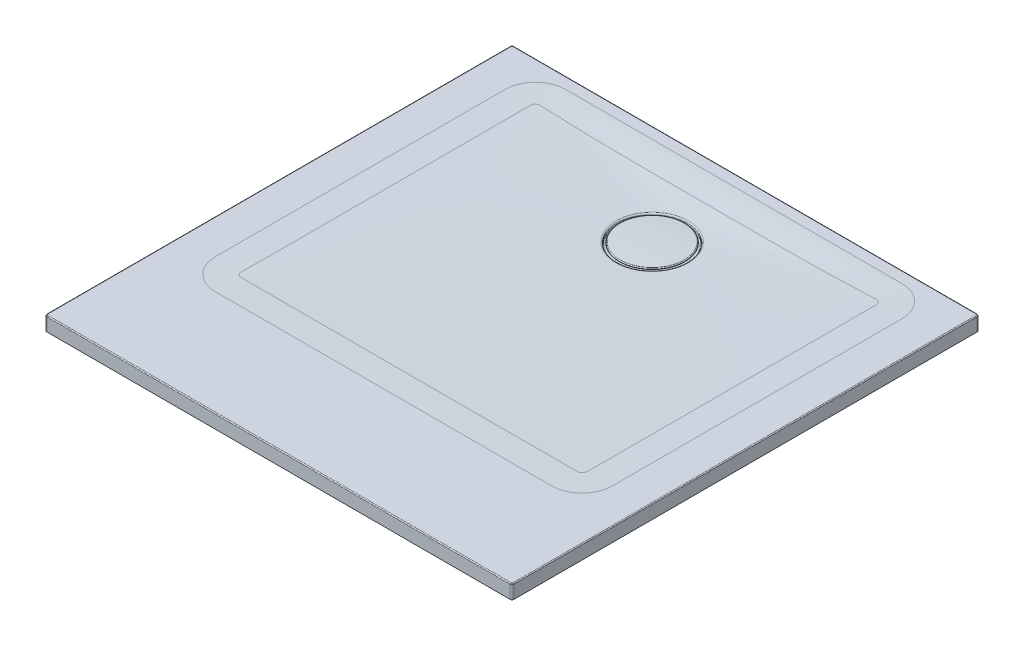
SolidWorks part; units mm, degrees
ref_plane "Płaszczyzna przednia" through (0, 0, 0) normal (0, 0, 1) x (1, 0, 0)
ref_plane "Płaszczyzna górna" through (0, 0, 0) normal (0, 1, 0) x (1, 0, 0)
ref_plane "Płaszczyzna prawa" through (0, 0, 0) normal (1, 0, 0) x (0, 0, -1)
sketch "Szkic2" plane through (0, 0, 0) normal (0, 1, 0) x (1, 0, 0)
  line L0 (0, 500) -> (0, 300) construction
  line L1 (-500, -500) -> (500, -500)
  line L2 (-500, -500) -> (-500, 500)
  line L3 (-500, 500) -> (500, 500)
  line L4 (500, -500) -> (500, 500)
  line L5 (-500, -500) -> (500, 500) construction
  line L6 (-500, 500) -> (500, -500) construction
  line L7 (-410, 460) -> (410, 460)
  line L8 (-410, 460) -> (-410, -260)
  line L9 (-410, -260) -> (410, -260)
  line L10 (410, 460) -> (410, -260)
  line L11 (-450, 500) -> (-450, -300) construction
  line L12 (-450, -300) -> (450, -300) construction
  line L13 (450, -300) -> (450, 500) construction
  circle A0 centre (0, 300) radius 75
  point P0 (0, 0)
  point P11 (0, 460)
  point P16 (0, -300)
  dimension "D9" = 150
  dimension "D1" = 1000
  dimension "D2" = 1000
  dimension "D3" = 40
  dimension "D4" = 90
  dimension "D5" = 40
  dimension "D6" = 50
  dimension "D7" = 800
  dimension "D8" = 200
  dimension "D10" = 900
sketch "Szkic3" plane through (0, 0, 0) normal (0, 1, 0) x (1, 0, 0)
  line L0 (-500, -500) -> (-500, 500) construction
  line L1 (-500, -500) -> (500, -500) construction
  line L2 (500, -500) -> (500, 500) construction
  line L3 (-500, 500) -> (500, 500) construction
  line L4 (-410, 460) -> (-410, -260) construction
  line L5 (-410, 460) -> (410, 460) construction
  line L6 (410, 460) -> (410, -260) construction
  line L7 (-410, -260) -> (410, -260) construction
  line L8 (-500, -500) -> (-500, 500)
  line L9 (-500, -500) -> (500, -500)
  line L10 (500, -500) -> (500, 500)
  line L11 (-500, 500) -> (500, 500)
  line L12 (-410, 410) -> (-410, -210)
  line L13 (-360, 460) -> (360, 460)
  line L14 (410, 410) -> (410, -210)
  line L15 (-360, -260) -> (360, -260)
  arc A0 (410, 410) -> (360, 460) centre (360, 410) ccw
  arc A1 (-360, 460) -> (-410, 410) centre (-360, 410) ccw
  arc A2 (360, -260) -> (410, -210) centre (360, -210) ccw
  arc A3 (-360, -260) -> (-410, -210) centre (-360, -210) cw
  dimension "D1" = 50
surface "Powierzchnia-Płaszczyzna1" sketch "Szkic3"
sketch "Szkic4" plane through (0, 0, 0) normal (0, 1, 0) x (1, 0, 0)
  line L0 (-410, 460) -> (-410, -260) construction
  line L1 (-410, -260) -> (410, -260) construction
  line L2 (410, 460) -> (410, -260) construction
  line L3 (-410, 460) -> (410, 460) construction
  line L4 (-410, 460) -> (-410, -260)
  line L5 (-410, -260) -> (410, -260)
  line L6 (410, 460) -> (410, -260)
  line L7 (-410, 460) -> (410, 460)
ref_plane "korek" through (0, -15, 0) normal (0, 1, 0) x (-1, 0, 0)
sketch "Szkic5" plane through (0, -15, 0) normal (0, 1, 0) x (-1, 0, 0)
  circle A0 centre (0, -300) radius 75 construction
  circle A1 centre (0, -300) radius 75
surface "Powierzchnia-Wyciągnięcie po profilach2"
surface "Powierzchnia-Połącz1"
sketch "Szkic7" plane through (0, 0, 0) normal (0, 1, 0) x (1, 0, 0)
  line L27 (360, 420) -> (-360, 420)
  line L28 (-370, 410) -> (-370, -210)
  line L29 (-360, -220) -> (360, -220)
  line L30 (370, -210) -> (370, 410)
  line L31 (360, 420) -> (-360, 420)
  line L32 (-370, 410) -> (-370, -210)
  line L33 (-360, -220) -> (360, -220)
  line L34 (370, -210) -> (370, 410)
  line L35 (360, 475) -> (-360, 475)
  line L36 (-425, 410) -> (-425, -210)
  line L37 (-360, -275) -> (360, -275)
  line L38 (425, -210) -> (425, 410)
  line L39 (360, 475) -> (-360, 475)
  line L40 (-425, 410) -> (-425, -210)
  line L41 (-360, -275) -> (360, -275)
  line L42 (425, -210) -> (425, 410)
  arc A0 (370, -210) -> (360, -220) centre (360, -210) cw
  arc A1 (-370, -210) -> (-360, -220) centre (-360, -210) ccw
  arc A2 (370, 410) -> (360, 420) centre (360, 410) ccw
  arc A3 (-370, 410) -> (-360, 420) centre (-360, 410) cw
  spline S23 degree 3 poles (-592.4486, 138.5364) (193.5356, 308.9072) (376.8272, 376.6336) (369.7449, 412.2677) (369.6659, 412.5844) (369.4756, 413.2123) (369.364, 413.5244) (368.988, 414.4323) (368.6811, 415.0064) (368.1375, 415.8214) (367.9415, 416.0861) (367.5237, 416.5957) (367.3038, 416.8382) (366.6124, 417.5299) (366.1096, 417.944) (365.2904, 418.4922) (365.0067, 418.6626) (364.4298, 418.9712) (364.1353, 419.1107) (363.5342, 419.3603) (363.2277, 419.4705) (362.6023, 419.661) (362.282, 419.7415) (236.2156, 445.0258) (-164.811, -2006.299) (83.1508, 1380.9055) knots -6.78642 -6.78642 -6.78642 -6.78642 0.125 0.125 0.1875 0.1875 0.25 0.25 0.375 0.375 0.4375 0.4375 0.5 0.5 0.625 0.625 0.6875 0.6875 0.75 0.75 0.8125 0.8125 0.875 0.875 25.213155 25.213155 25.213155 25.213155 only from (370, 410) to (360, 420)
  spline S24 degree 3 poles (-76.6898, -539.0264) (-242.5598, 196.2448) (-322.6247, 427.6485) (-362.2675, 419.7448) (-362.5842, 419.6659) (-363.212, 419.4758) (-363.5241, 419.3642) (-364.432, 418.9882) (-365.006, 418.6812) (-365.8211, 418.1377) (-366.0858, 417.9417) (-366.5954, 417.5239) (-366.8379, 417.3041) (-367.5297, 416.6128) (-367.9437, 416.1099) (-368.492, 415.2909) (-368.6624, 415.0071) (-368.971, 414.4302) (-369.1106, 414.1357) (-369.3601, 413.5346) (-369.4702, 413.2279) (-369.6609, 412.6026) (-369.7416, 412.2824) (-378.661, 367.6654) (-84.5643, 289.7021) (600.3493, 168.3042) knots -7.572445 -7.572445 -7.572445 -7.572445 0.125 0.125 0.1875 0.1875 0.25 0.25 0.375 0.375 0.4375 0.4375 0.5 0.5 0.625 0.625 0.6875 0.6875 0.75 0.75 0.8125 0.8125 0.875 0.875 9.446329 9.446329 9.446329 9.446329 only from (-360, 420) to (-370, 410)
  spline S25 degree 3 poles (592.4461, 61.463) (-193.536, -108.9074) (-376.8272, -176.6337) (-369.7449, -212.2677) (-369.6659, -212.5844) (-369.4756, -213.2123) (-369.364, -213.5244) (-368.988, -214.4323) (-368.6811, -215.0064) (-368.1375, -215.8214) (-367.9415, -216.0861) (-367.5237, -216.5957) (-367.3038, -216.8382) (-366.6124, -217.5299) (-366.1096, -217.944) (-365.2904, -218.4922) (-365.0067, -218.6626) (-364.4298, -218.9712) (-364.1353, -219.1107) (-363.5342, -219.3603) (-363.2277, -219.4705) (-362.6023, -219.661) (-362.282, -219.7415) (-236.2157, -245.0258) (164.8102, 2206.2941) (-83.15, -1180.8953) knots -6.786412 -6.786412 -6.786412 -6.786412 0.125 0.125 0.1875 0.1875 0.25 0.25 0.375 0.375 0.4375 0.4375 0.5 0.5 0.625 0.625 0.6875 0.6875 0.75 0.75 0.8125 0.8125 0.875 0.875 25.213131 25.213131 25.213131 25.213131 only from (-370, -210) to (-360, -220)
  spline S26 degree 3 poles (76.6897, 739.0267) (242.5598, 3.7552) (322.6247, -227.6485) (362.2675, -219.7448) (362.5842, -219.6659) (363.212, -219.4758) (363.5241, -219.3642) (364.432, -218.9882) (365.006, -218.6812) (365.8211, -218.1377) (366.0858, -217.9417) (366.5954, -217.5239) (366.8379, -217.3041) (367.5297, -216.6128) (367.9437, -216.1099) (368.492, -215.2909) (368.6624, -215.0071) (368.971, -214.4302) (369.1106, -214.1357) (369.3601, -213.5346) (369.4702, -213.2279) (369.6609, -212.6026) (369.7416, -212.2824) (378.661, -167.6654) (84.5643, -89.7021) (-600.3493, 31.6958) knots -7.572445 -7.572445 -7.572445 -7.572445 0.125 0.125 0.1875 0.1875 0.25 0.25 0.375 0.375 0.4375 0.4375 0.5 0.5 0.625 0.625 0.6875 0.6875 0.75 0.75 0.8125 0.8125 0.875 0.875 9.446329 9.446329 9.446329 9.446329 only from (360, -220) to (370, -210)
  spline S31 degree 3 poles (-2397.3904, -564.8736) (-137.8356, -11.0695) (456.2373, 259.141) (423.3422, 424.7391) (422.8283, 426.7975) (421.9013, 429.8585) (421.5657, 430.8761) (420.844, 432.8947) (420.4595, 433.8909) (418.4227, 438.8085) (416.4283, 442.5403) (413.4834, 446.9547) (412.8717, 447.8249) (411.6018, 449.5398) (410.9419, 450.3865) (408.905, 452.8706) (407.476, 454.4469) (402.9824, 458.9435) (399.7134, 461.6344) (395.277, 464.6046) (394.3695, 465.1804) (392.535, 466.2816) (391.6076, 466.8075) (388.7955, 468.3124) (386.881, 469.219) (382.9737, 470.8415) (380.9809, 471.5575) (377.932, 472.4866) (376.9058, 472.7721) (374.8331, 473.2938) (373.7847, 473.5305) (370.6359, 474.16) (368.5249, 474.4737) (209.2363, 490.2262) (-10.9626, -61.4028) (-430.2767, -2404.6821) knots -4.798718 -4.798718 -4.798718 -4.798718 0.125 0.125 0.1875 0.1875 0.21875 0.21875 0.25 0.25 0.375 0.375 0.40625 0.40625 0.4375 0.4375 0.5 0.5 0.625 0.625 0.65625 0.65625 0.6875 0.6875 0.75 0.75 0.8125 0.8125 0.84375 0.84375 0.875 0.875 0.9375 0.9375 5.565426 5.565426 5.565426 5.565426 only from (425, 410) to (360, 475)
  spline S32 degree 3 poles (554.3044, -2369.4712) (-0.8262, 35.9994) (-223.3667, 488.7883) (-368.4945, 474.4773) (-370.5875, 474.1671) (-374.7388, 473.3421) (-376.7971, 472.8284) (-379.8581, 471.9015) (-380.8756, 471.5658) (-382.8942, 470.8441) (-383.8905, 470.4597) (-388.8081, 468.4229) (-392.5399, 466.4284) (-396.9543, 463.4837) (-397.8246, 462.872) (-399.5394, 461.6021) (-400.3861, 460.9422) (-402.8703, 458.9053) (-404.4465, 457.4763) (-408.9433, 452.9828) (-411.634, 449.7137) (-414.6044, 445.2775) (-415.1801, 444.37) (-416.2813, 442.5355) (-416.8072, 441.6081) (-418.3122, 438.7959) (-419.2188, 436.8814) (-420.8413, 432.974) (-421.5572, 430.9811) (-422.4864, 427.9324) (-422.7721, 426.9062) (-423.2939, 424.8335) (-423.5304, 423.7851) (-462.5445, 228.537) (393.0623, -65.0247) (2420.6115, -488.7817) knots -4.172929 -4.172929 -4.172929 -4.172929 0.0625 0.0625 0.125 0.125 0.1875 0.1875 0.21875 0.21875 0.25 0.25 0.375 0.375 0.40625 0.40625 0.4375 0.4375 0.5 0.5 0.625 0.625 0.65625 0.65625 0.6875 0.6875 0.75 0.75 0.8125 0.8125 0.84375 0.84375 0.875 0.875 6.656638 6.656638 6.656638 6.656638 only from (-360, 475) to (-425, 410)
  spline S33 degree 3 poles (2397.3905, 764.8736) (137.8356, 211.0695) (-456.2373, -59.141) (-423.3422, -224.7391) (-422.8283, -226.7975) (-421.9013, -229.8585) (-421.5657, -230.8761) (-420.844, -232.8947) (-420.4595, -233.8909) (-418.4227, -238.8085) (-416.4283, -242.5403) (-413.4834, -246.9547) (-412.8717, -247.8249) (-411.6018, -249.5398) (-410.9419, -250.3865) (-408.905, -252.8706) (-407.476, -254.4469) (-402.9824, -258.9435) (-399.7134, -261.6344) (-395.277, -264.6046) (-394.3695, -265.1804) (-392.535, -266.2816) (-391.6076, -266.8075) (-388.7955, -268.3124) (-386.881, -269.219) (-382.9737, -270.8415) (-380.9809, -271.5575) (-377.932, -272.4866) (-376.9058, -272.7721) (-374.8331, -273.2938) (-373.7847, -273.5305) (-370.6359, -274.16) (-368.5249, -274.4737) (-209.2363, -290.2262) (10.9626, 261.4028) (430.2767, 2604.6821) knots -4.798718 -4.798718 -4.798718 -4.798718 0.125 0.125 0.1875 0.1875 0.21875 0.21875 0.25 0.25 0.375 0.375 0.40625 0.40625 0.4375 0.4375 0.5 0.5 0.625 0.625 0.65625 0.65625 0.6875 0.6875 0.75 0.75 0.8125 0.8125 0.84375 0.84375 0.875 0.875 0.9375 0.9375 5.565426 5.565426 5.565426 5.565426 only from (-425, -210) to (-360, -275)
  spline S34 degree 3 poles (-554.3044, 2569.4712) (0.8262, 164.0006) (223.3667, -288.7883) (368.4945, -274.4773) (370.5875, -274.1671) (374.7388, -273.3421) (376.7971, -272.8284) (379.8581, -271.9015) (380.8756, -271.5658) (382.8942, -270.8441) (383.8905, -270.4597) (388.8081, -268.4229) (392.5399, -266.4284) (396.9543, -263.4837) (397.8246, -262.872) (399.5394, -261.6021) (400.3861, -260.9422) (402.8703, -258.9053) (404.4465, -257.4763) (408.9433, -252.9828) (411.634, -249.7137) (414.6044, -245.2775) (415.1801, -244.37) (416.2813, -242.5355) (416.8072, -241.6081) (418.3122, -238.7959) (419.2188, -236.8814) (420.8413, -232.974) (421.5572, -230.9811) (422.4864, -227.9324) (422.7721, -226.9062) (423.2939, -224.8335) (423.5304, -223.7851) (462.5445, -28.537) (-393.0623, 265.0247) (-2420.6115, 688.7817) knots -4.172929 -4.172929 -4.172929 -4.172929 0.0625 0.0625 0.125 0.125 0.1875 0.1875 0.21875 0.21875 0.25 0.25 0.375 0.375 0.40625 0.40625 0.4375 0.4375 0.5 0.5 0.625 0.625 0.65625 0.65625 0.6875 0.6875 0.75 0.75 0.8125 0.8125 0.84375 0.84375 0.875 0.875 6.656638 6.656638 6.656638 6.656638 only from (360, -275) to (425, -210)
  spline S35 degree 3 poles (425, 410) (425, 414.2918) (424.5792, 418.512) (423.3422, 424.7391) (422.8283, 426.7975) (421.9013, 429.8585) (421.5657, 430.8761) (420.844, 432.8947) (420.4595, 433.8909) (418.4227, 438.8085) (416.4283, 442.5403) (413.4834, 446.9547) (412.8717, 447.8249) (411.6018, 449.5398) (410.9419, 450.3865) (408.905, 452.8706) (407.476, 454.4469) (402.9824, 458.9435) (399.7134, 461.6344) (395.277, 464.6046) (394.3695, 465.1804) (392.535, 466.2816) (391.6076, 466.8075) (388.7955, 468.3124) (386.881, 469.219) (382.9737, 470.8415) (380.9809, 471.5575) (377.932, 472.4866) (376.9058, 472.7721) (374.8331, 473.2938) (373.7847, 473.5305) (370.6359, 474.16) (368.5249, 474.4737) (364.2799, 474.8935) (362.1459, 475) (360, 475) knots 0 0 0 0 0.125 0.125 0.1875 0.1875 0.21875 0.21875 0.25 0.25 0.375 0.375 0.40625 0.40625 0.4375 0.4375 0.5 0.5 0.625 0.625 0.65625 0.65625 0.6875 0.6875 0.75 0.75 0.8125 0.8125 0.84375 0.84375 0.875 0.875 0.9375 0.9375 1 1 1 1
  spline S36 degree 3 poles (-360, 475) (-362.1459, 475) (-364.2736, 474.8936) (-368.4945, 474.4773) (-370.5875, 474.1671) (-374.7388, 473.3421) (-376.7971, 472.8284) (-379.8581, 471.9015) (-380.8756, 471.5658) (-382.8942, 470.8441) (-383.8905, 470.4597) (-388.8081, 468.4229) (-392.5399, 466.4284) (-396.9543, 463.4837) (-397.8246, 462.872) (-399.5394, 461.6021) (-400.3861, 460.9422) (-402.8703, 458.9053) (-404.4465, 457.4763) (-408.9433, 452.9828) (-411.634, 449.7137) (-414.6044, 445.2775) (-415.1801, 444.37) (-416.2813, 442.5355) (-416.8072, 441.6081) (-418.3122, 438.7959) (-419.2188, 436.8814) (-420.8413, 432.974) (-421.5572, 430.9811) (-422.4864, 427.9324) (-422.7721, 426.9062) (-423.2939, 424.8335) (-423.5304, 423.7851) (-424.5791, 418.5369) (-425, 414.2918) (-425, 410) knots 0 0 0 0 0.0625 0.0625 0.125 0.125 0.1875 0.1875 0.21875 0.21875 0.25 0.25 0.375 0.375 0.40625 0.40625 0.4375 0.4375 0.5 0.5 0.625 0.625 0.65625 0.65625 0.6875 0.6875 0.75 0.75 0.8125 0.8125 0.84375 0.84375 0.875 0.875 1 1 1 1
  spline S37 degree 3 poles (-425, -210) (-425, -214.2918) (-424.5792, -218.512) (-423.3422, -224.7391) (-422.8283, -226.7975) (-421.9013, -229.8585) (-421.5657, -230.8761) (-420.844, -232.8947) (-420.4595, -233.8909) (-418.4227, -238.8085) (-416.4283, -242.5403) (-413.4834, -246.9547) (-412.8717, -247.8249) (-411.6018, -249.5398) (-410.9419, -250.3865) (-408.905, -252.8706) (-407.476, -254.4469) (-402.9824, -258.9435) (-399.7134, -261.6344) (-395.277, -264.6046) (-394.3695, -265.1804) (-392.535, -266.2816) (-391.6076, -266.8075) (-388.7955, -268.3124) (-386.881, -269.219) (-382.9737, -270.8415) (-380.9809, -271.5575) (-377.932, -272.4866) (-376.9058, -272.7721) (-374.8331, -273.2938) (-373.7847, -273.5305) (-370.6359, -274.16) (-368.5249, -274.4737) (-364.2799, -274.8935) (-362.1459, -275) (-360, -275) knots 0 0 0 0 0.125 0.125 0.1875 0.1875 0.21875 0.21875 0.25 0.25 0.375 0.375 0.40625 0.40625 0.4375 0.4375 0.5 0.5 0.625 0.625 0.65625 0.65625 0.6875 0.6875 0.75 0.75 0.8125 0.8125 0.84375 0.84375 0.875 0.875 0.9375 0.9375 1 1 1 1
  spline S38 degree 3 poles (360, -275) (362.1459, -275) (364.2736, -274.8936) (368.4945, -274.4773) (370.5875, -274.1671) (374.7388, -273.3421) (376.7971, -272.8284) (379.8581, -271.9015) (380.8756, -271.5658) (382.8942, -270.8441) (383.8905, -270.4597) (388.8081, -268.4229) (392.5399, -266.4284) (396.9543, -263.4837) (397.8246, -262.872) (399.5394, -261.6021) (400.3861, -260.9422) (402.8703, -258.9053) (404.4465, -257.4763) (408.9433, -252.9828) (411.634, -249.7137) (414.6044, -245.2775) (415.1801, -244.37) (416.2813, -242.5355) (416.8072, -241.6081) (418.3122, -238.7959) (419.2188, -236.8814) (420.8413, -232.974) (421.5572, -230.9811) (422.4864, -227.9324) (422.7721, -226.9062) (423.2939, -224.8335) (423.5304, -223.7851) (424.5791, -218.5369) (425, -214.2918) (425, -210) knots 0 0 0 0 0.0625 0.0625 0.125 0.125 0.1875 0.1875 0.21875 0.21875 0.25 0.25 0.375 0.375 0.40625 0.40625 0.4375 0.4375 0.5 0.5 0.625 0.625 0.65625 0.65625 0.6875 0.6875 0.75 0.75 0.8125 0.8125 0.84375 0.84375 0.875 0.875 1 1 1 1
  dimension "D3" = 10
  dimension "D1" = 40
  dimension "D2" = 15
other "Usuń ścianę1"
other "Granica-Powierzchnia1"
surface "Powierzchnia-Połącz2"
sketch "Szkic9" plane through (0, 0, 0) normal (0, 1, 0) x (1, 0, 0)
  line L0 (-500, -500) -> (500, -500) construction
  line L1 (-500, -500) -> (-500, 500) construction
  line L2 (500, -500) -> (500, 500) construction
  line L3 (-500, 500) -> (500, 500) construction
  line L4 (-500, -500) -> (500, -500)
  line L5 (-500, -500) -> (-500, 500)
  line L6 (500, -500) -> (500, 500)
  line L7 (-500, 500) -> (500, 500)
surface "Powierzchnia-Wyciągnięcie1" sketch "Szkic9" parameters "D1"=30
sketch "Szkic8" plane through (0, 0, 0) normal (1, 0, 0) x (0, 0, -1)
  line L0 (300, 0) -> (300, -30) construction
  line L1 (224.9999, -15) -> (225.2968, -23.5)
  line L4 (225.2968, -23.5) -> (248, -24.0945)
  line L5 (225.2968, -23.5) -> (300, -23.5) construction
  line L6 (248, -24.0945) -> (248, -30) construction
  line L7 (300, -30) -> (225.2968, -30) construction
  line L8 (225.2968, -30) -> (225.2968, -23.5) construction
  line L9 (255, -28) -> (255, -30)
  line L10 (248, -24.0945) -> (255, -28)
  dimension "D1" = 30
  dimension "D2" = 8.5
  dimension "D3" = 2
  dimension "D4" = 1.5
  dimension "D5" = 52
  dimension "D6" = 45
  dimension "D7" = 2
surface "Powierzchnia-Obrót1" sketch "Szkic8" parameters "D1"=360
surface "Powierzchnia-Płaszczyzna2"
surface "Powierzchnia-Połącz3"
fillet "Zaokrąglenie4" radius 4 4 edges at (-500, -15, -500) (500, -15, -500) (-500, -15, 500) (500, -15, 500)
fillet "Zaokrąglenie5" radius 3 3 edges at (0, -24.0945, -352) (0, -23.5, -374.7032)
fillet "Zaokrąglenie6" radius 2 9 edges at (498.8284, 0, 498.8284) (0, 0, 500) (-498.8284, 0, 498.8284) (-500, 0, 0) (-498.8284, 0, -498.8284) (0, 0, -500) (498.8284, 0, -498.8284) (500, 0, 0) (0, -28, -345)
sketch "Szkic11" plane through (0, 0, 0) normal (1, 0, 0) x (0, 0, -1)
  line L0 (300, 0) -> (300, -30) construction
  line L1 (-496, -30) -> (496, -30) construction
  line L2 (300, -17) -> (300, -11.5)
  line L14 (370, -11.5) -> (370, -14.5) construction
  line L16 (370, -17) -> (300, -17)
  line L18 (370, -17) -> (370, -16.3377)
  line L19 (300, -11.5) -> (370, -11.5) construction
  arc A0 (370, -16.3377) -> (368.1666, -14.3446) centre (368, -16.3377) ccw
  arc A6 (368.1666, -14.3446) -> (300, -11.5) centre (300, -829.6667) ccw
  dimension "D2" = 2
  dimension "D8" = 2.5
  dimension "D9" = 17
  dimension "D10" = 5.5
  dimension "D11" = 70
revolve "Obrót1" add sketch "Szkic11" angle 360 about L0
